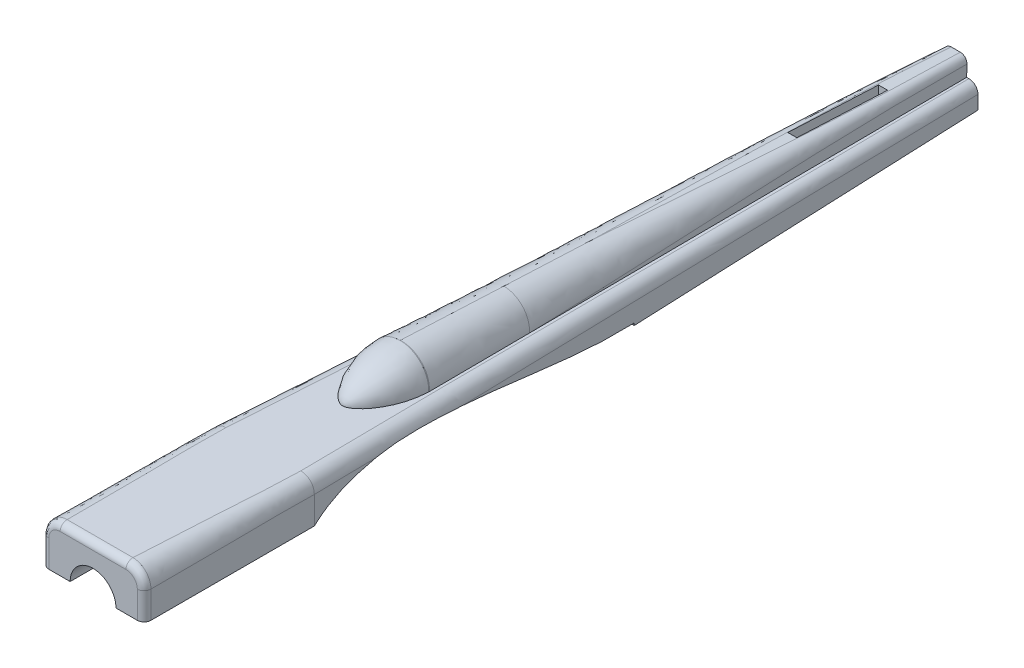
SolidWorks part; units mm, degrees
ref_plane "Plan de face" through (0, 0, 0) normal (0, 0, 1) x (1, 0, 0)
ref_plane "Plan de dessus" through (0, 0, 0) normal (0, 1, 0) x (1, 0, 0)
ref_plane "Plan de droite" through (0, 0, 0) normal (1, 0, 0) x (0, 0, -1)
sketch "Esquisse1" plane through (0, 0, 0) normal (1, 0, 0) x (0, 0, -1)
  line L0 (-79.0921, 0) -> (468.674, 0) construction
  line L1 (0, -9.7598) -> (0, 78.2756) construction
  line L2 (-75, 123.8092) -> (-75, -26.5263) construction
  line L3 (305, 123.8092) -> (305, -26.5263) construction
  line L4 (-79.0921, 20) -> (468.674, 20) construction
  line L5 (377.9542, 10) -> (288.8267, 10) construction
  line L6 (-75, 20) -> (305, 10)
  line L7 (305, 10) -> (305, 0)
  line L8 (305, 0) -> (147, 0)
  line L9 (147, 0) -> (147, 1)
  line L10 (0, 0) -> (-75, 0)
  line L11 (-75, 0) -> (-75, 20)
  line L23 (68.3657, 10) -> (70.9543, 10) construction
  line L24 (76.7786, 9) -> (81.4381, 9) construction
  line L30 (147, 20.3151) -> (147, -36.2431) construction
  spline S0 degree 3 poles (0, 0) (10.0154, 8.6682) (26.514, 12.1435) (52.9406, 12.2543) (89.4118, 8.6393) (124.8589, 1.0117) (147, 1) knots 0 0 0 0 0.279871 0.279871 0.548423 1 1 1 1
  dimension "D1" = 380
  dimension "D2" = 75
  dimension "D3" = 20
  dimension "D4" = 10
extrude "Boss.-Extru.1" add sketch "Esquisse1" along normal blind 45
sketch "Esquisse2" plane through (0, 0, 0) normal (0, -1, 0) x (1, 0, 0)
  line L0 (22.5, -324.2841) -> (22.5, 89.016) construction
  line L1 (12.5, -342.3367) -> (12.5, -268.7304) construction
  line L2 (32.5, -342.3367) -> (32.5, -268.7304) construction
  line L3 (63.4067, 0) -> (-123.9165, 0) construction
  line L4 (45, 0) -> (46.4036, -306.5447)
  line L5 (45, 75) -> (45, 0) construction
  line L6 (46.4036, -306.5447) -> (32.5, -305)
  line L7 (45, -305) -> (0, -305) construction
  line L8 (32.5, -305) -> (45, 0)
  line L9 (12.5, -305) -> (0, 0)
  line L10 (12.5, -305) -> (-2.198, -306.5447)
  line L11 (-2.198, -306.5447) -> (0, 0)
  dimension "D1" = 10
  dimension "D2" = 20
extrude "Enlèv. mat.-Extru.1" cut sketch "Esquisse2" against normal blind 22
fillet "Congé variable1" radius 8 4 edges at (38.75, 14.0132, -152.5) (45, 19.0132, 37.5) (6.25, 14.0132, -152.5) (0, 19.0132, 37.5)
sketch "Esquisse3" plane through (0, 18.0138, -0.474) normal (0, 0.9997, -0.0263) x (1, 0, 0)
  line L0 (22.5, -95.5873) -> (22.5, 317.3675) construction
  line L1 (68.7967, -75.5002) -> (-29.5837, -75.5002) construction
  line L2 (68.7967, 34.4998) -> (-29.5837, 34.4998) construction
  line L3 (-6.8377, 59.4998) -> (68.7967, 59.4998) construction
  line L4 (35.5, 50.3264) -> (35.5, 77.1) construction
  line L5 (27.5, 306.9967) -> (27.5, 294.6866) construction
  line L6 (35.5, 59.4998) -> (27.5, 304.6314)
  line L7 (28.501, 304.6314) -> (16.499, 304.6314) construction
  line L8 (9.5, 59.4998) -> (17.5, 304.6314)
  line L9 (17.5, 304.6314) -> (27.5, 304.6314)
  line L10 (35.5, 59.4998) -> (9.5, 59.4998)
  dimension "D1" = 110
  dimension "D2" = 25
  dimension "D3" = 13
  dimension "D4" = 5
extrude "Boss.-Extru.2" add sketch "Esquisse3" along normal blind 13
ref_plane "Plan1" through (22.5, 0, 0) normal (1, 0, 0) x (0, 0, -1)
sketch "Esquisse5" plane through (22.5, 0, 0) normal (1, 0, 0) x (0, 0, -1)
  line L0 (-75, -13.3823) -> (-75, 74.6396) construction
  line L1 (35, -13.3823) -> (35, 74.6396) construction
  line L2 (60.2953, 29.4441) -> (59.9533, 16.4486)
  line L3 (59.9533, 16.4486) -> (35, 17.1053)
  line L4 (305, 10) -> (0.0351, 18.0254) construction
  spline S0 degree 3 poles (35, 17.1053) (35.1264, 21.4812) (45.6894, 29.6228) (60.2953, 29.4441) knots 0 0 0 0 0.807364 0.807364 0.807364 0.807364
  dimension "D1" = 110
revolve "Révolution1" add sketch "Esquisse5" angle 180 mid plane about L3
sketch "Esquisse6" plane through (22.5, 0, 0) normal (1, 0, 0) x (0, 0, -1)
  line L0 (307.9161, 10) -> (323.7674, 10) construction
  line L1 (295.0711, 18) -> (323.7674, 18) construction
  line L2 (60.2953, 31.2112) -> (60.2953, 25.467) construction
  line L3 (60.0035, 29.4518) -> (60.9502, 29.4269) construction
  line L4 (60.2953, 29.4441) -> (305.342, 22.9955) construction
  line L5 (305.2105, 18) -> (60.2953, 29.4441)
  line L6 (305.342, 22.9955) -> (305, 10) construction
  line L7 (60.2953, 29.4441) -> (306.4252, 23.722)
  line L8 (306.4252, 23.722) -> (305.2105, 18)
  dimension "D1" = 8
extrude "Enlèv. mat.-Extru.3" cut sketch "Esquisse6" against normal mid plane 27
fillet "Congé2" radius 3 5 edges at (45, 5.9986, 75) (43.0051, 17.2847, 75) (0, 5.9986, 75) (2.7151, 18.0051, 75) (22.5, 20, 75)
fillet "Congé variable6" radius 13 1 edges at (31.5, 23.722, -182.7529)
fillet "Congé variable7" radius 3 1 edges at (13.5, 23.722, -182.7529)
sketch "Esquisse7" plane through (0, 0, 75) normal (0, 0, 1) x (1, 0, 0)
  line L0 (42, 0) -> (3, 0) construction
  circle A0 centre (22.5, 0) radius 10.1
extrude "Enlèv. mat.-Extru.4" cut sketch "Esquisse7" against normal blind 110
ref_plane "Plan2" through (0, 0, 0) normal (0, 1, 0) x (-1, 0, 0)
sketch "Esquisse8" plane through (0, 0, 0) normal (0, 1, 0) x (-1, 0, 0)
  line L0 (-45.2199, -305.2105) -> (-10.8761, -305.2105) construction
  line L1 (-45.2199, -273.1605) -> (-10.8761, -273.1605) construction
  line L2 (-45.2199, -233.1605) -> (-5.2328, -233.1605) construction
  line L3 (-20.5, -312.277) -> (-20.5, -249.5553) construction
  line L4 (-22.5, 20.9059) -> (-22.5, -20.9059) construction
  line L5 (-24.5, -312.277) -> (-24.5, -219.7613) construction
  line L7 (-20.5, -233.1605) -> (-24.5, -233.1605)
  line L8 (-20.5, -233.1605) -> (-20.5, -273.1605)
  line L9 (-20.5, -273.1605) -> (-24.5, -273.1605)
  line L10 (-24.5, -233.1605) -> (-24.5, -273.1605)
  spline S0 degree 3 poles (-22.4964, -144.2195) (-23.7043, -197.8682) (-26.2528, -251.5606) (-24.5036, -305.1129) (-24.5025, -305.1454) (-24.5015, -305.178) (-24.5004, -305.2105) knots -0.245411 -0.245411 -0.245411 -0.245411 -0.084493 -0.084493 -0.084493 -0.084395 -0.084395 -0.084395 -0.084395 weights 1 1 1 1 1 1 1 construction
  dimension "D1" = 40
  dimension "D2" = 4
  dimension "D3" = 32.05
  dimension "D4" = 2
extrude "Enlèv. mat.-Extru.5" cut sketch "Esquisse8" along normal through all
